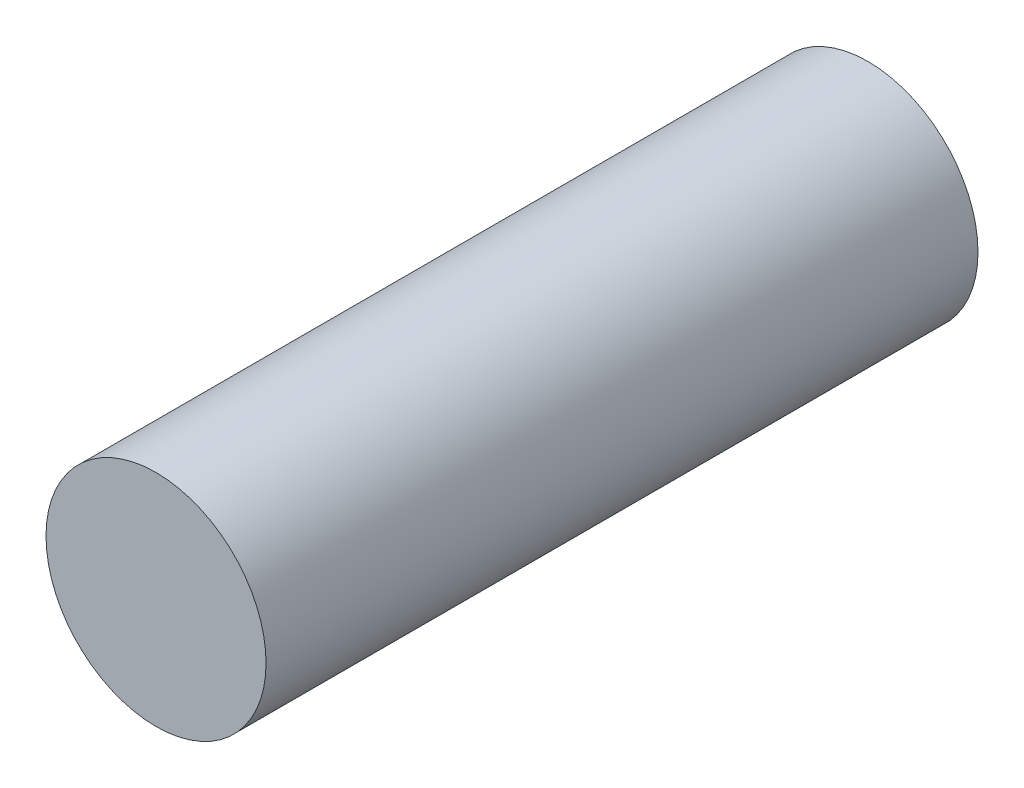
SolidWorks part; units mm, degrees
ref_plane "Front Plane" through (0, 0, 0) normal (0, 0, 1) x (1, 0, 0)
ref_plane "Top Plane" through (0, 0, 0) normal (0, 1, 0) x (1, 0, 0)
ref_plane "Right Plane" through (0, 0, 0) normal (1, 0, 0) x (0, 0, -1)
sketch "Sketch1" plane through (0, 0, 0) normal (0, 0, 1) x (1, 0, 0)
  circle A0 centre (0, 0) radius 0.6477
extrude "Boss-Extrude1" add sketch "Sketch1" along normal blind 4.191
